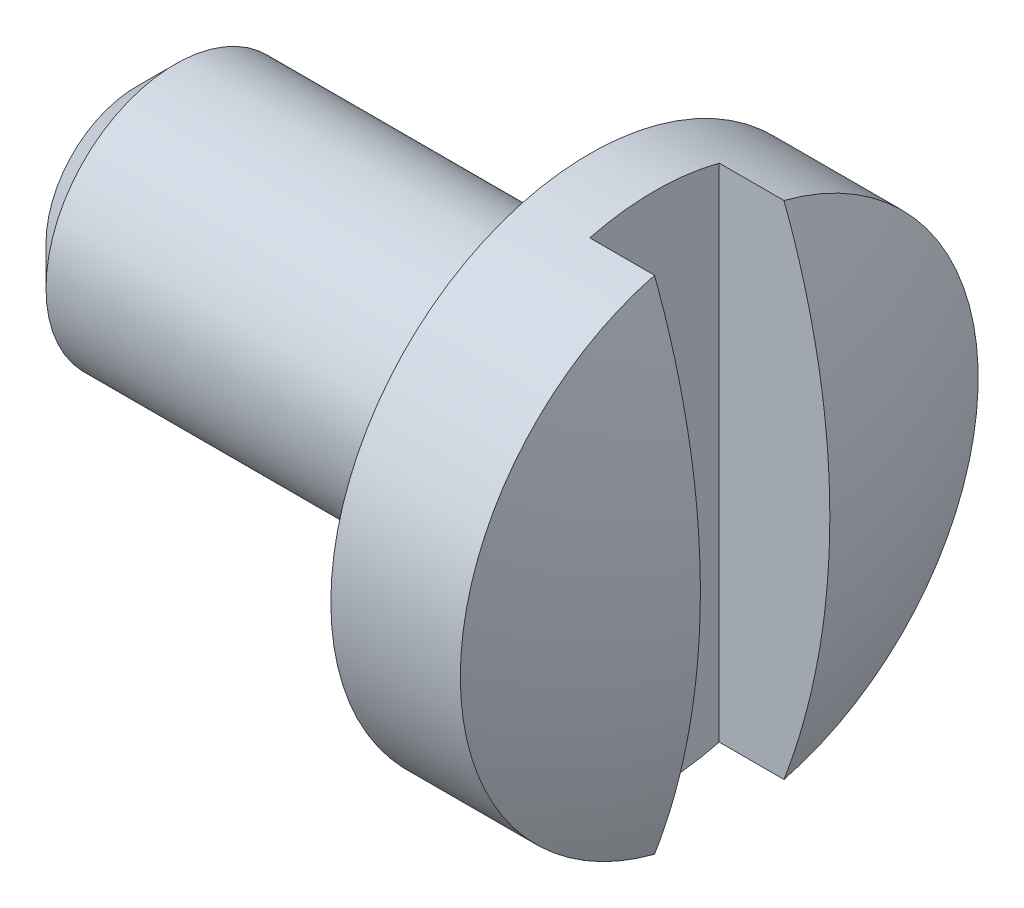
SolidWorks part; units mm, degrees
ref_plane "Plan de face" through (0, 0, 0) normal (0, 0, 1) x (1, 0, 0)
ref_plane "Plan de dessus" through (0, 0, 0) normal (0, 1, 0) x (1, 0, 0)
ref_plane "Plan de droite" through (0, 0, 0) normal (1, 0, 0) x (0, 0, -1)
sketch "Esquisse1" plane through (0, 0, 0) normal (0, 0, 1) x (1, 0, 0)
  line L0 (-2.5, 0) -> (-2.5, 0.7)
  line L1 (-2.5, 0.7) -> (-2.2, 1)
  line L2 (-2.2, 1) -> (1, 1)
  line L3 (1, 1) -> (1, 2)
  line L4 (1, 2) -> (2, 2)
  line L5 (-3.9636, 0) -> (2.4854, 0) construction
  line L6 (2.3765, 0) -> (-2.5, 0)
  arc A0 (2, 2) -> (2.3765, 0) centre (-3.1235, 0) cw
  dimension "D1" = 2.5
  dimension "D8" = 5.5
  dimension "D2" = 1
  dimension "D3" = 1
  dimension "D4" = 1
  dimension "D5" = 45
  dimension "D6" = 0.3
  dimension "D7" = 2
revolve "Révolution1" add sketch "Esquisse1" angle 360 about L5
ref_plane "Plan1" through (1.5, 0, 0) normal (1, 0, 0) x (0, 0, -1)
sketch "Esquisse2" plane through (1.5, 0, 0) normal (1, 0, 0) x (0, 0, -1)
  line L1 (-0.5, 2.5) -> (0.5, 2.5)
  line L2 (-0.5, 2.5) -> (-0.5, -2.5)
  line L3 (-0.5, -2.5) -> (0.5, -2.5)
  line L4 (0.5, 2.5) -> (0.5, -2.5)
  dimension "D1" = 1
  dimension "D2" = 5
  dimension "D3" = 2.5
  dimension "D4" = 0.5
extrude "Enlèv. mat.-Extru.1" cut sketch "Esquisse2" along normal through all
